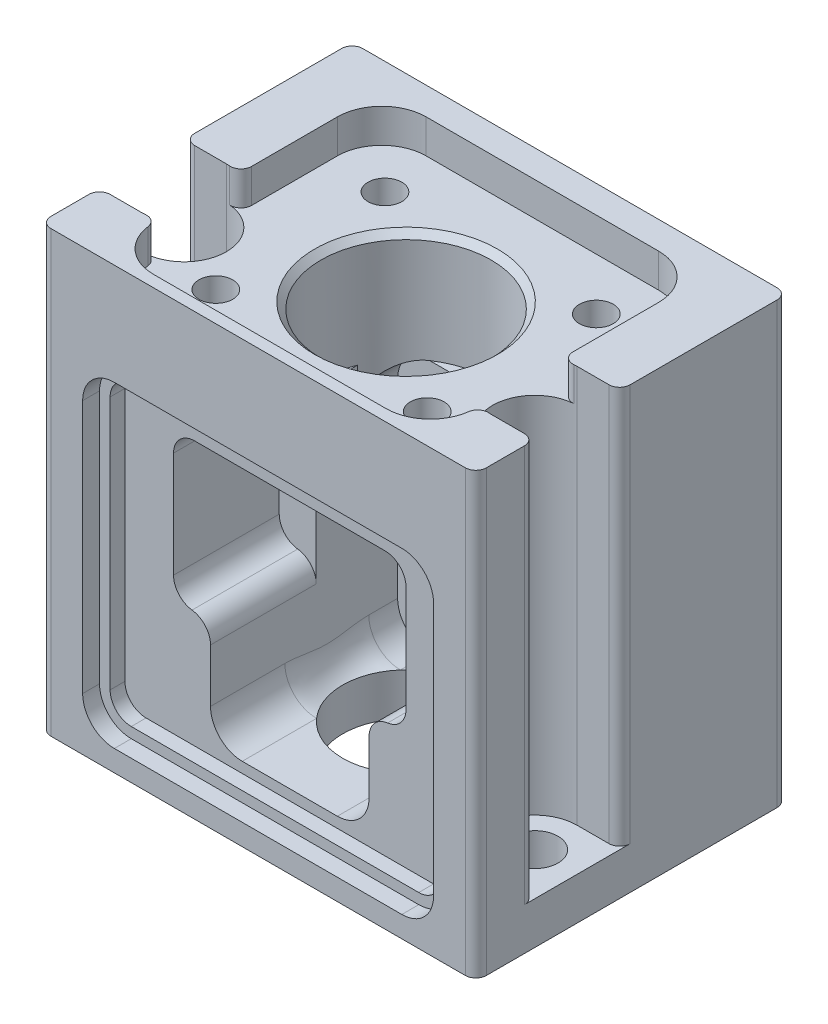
SolidWorks part; units mm, degrees
ref_plane "前视基准面" through (0, 0, 0) normal (0, 0, 1) x (1, 0, 0)
ref_plane "上视基准面" through (0, 0, 0) normal (0, 1, 0) x (1, 0, 0)
ref_plane "右视基准面" through (0, 0, 0) normal (1, 0, 0) x (0, 0, -1)
sketch "草图1" plane through (0, 0, 0) normal (0, 1, 0) x (1, 0, 0)
  line L1 (-10.3, 6.875) -> (10.3, 6.875)
  line L2 (-10.3, 6.875) -> (-10.3, -6.875)
  line L3 (-10.3, -6.875) -> (10.3, -6.875)
  line L4 (10.3, 6.875) -> (10.3, -6.875)
  line L5 (-10.3, 6.875) -> (10.3, -6.875) construction
  line L6 (-10.3, -6.875) -> (10.3, 6.875) construction
  point P0 (0, 0)
  dimension "D1" = 20.6
  dimension "D2" = 13.75
extrude "凸台-拉伸1" add sketch "草图1" along normal blind 22
sketch "草图3" plane through (0, 0, 0) normal (0, -1, 0) x (1, 0, 0)
  line L0 (10.3, -6.875) -> (-10.3, -6.875) construction
  line L1 (-10.3, -6.875) -> (-10.3, 6.875) construction
  circle A0 centre (-6, -0.625) radius 0.975
  circle A1 centre (7, -0.625) radius 0.975
  dimension "D1" = 6.25
  dimension "D2" = 6.25
  dimension "D3" = 4.3
  dimension "D4" = 13
  dimension "D5" = 1.95
extrude "切除-拉伸1" cut sketch "草图3" against normal blind 4
sketch "草图4" plane through (0, 0, 0) normal (0, -1, 0) x (1, 0, 0)
  circle A0 centre (-6, -0.625) radius 1.025
  circle A1 centre (7, -0.625) radius 1.025
  dimension "D1" = 2.05
extrude "切除-拉伸2" cut sketch "草图4" against normal blind 2
sketch "草图5" plane through (0, 0, 6.875) normal (0, 0, 1) x (1, 0, 0)
  line L4 (-10.3, 0) -> (10.3, 0)
  line L5 (10.3, 0) -> (10.3, 22)
  line L6 (10.3, 22) -> (-10.3, 22)
  line L7 (-10.3, 22) -> (-10.3, 0)
  line L8 (-10.3, 0) -> (10.3, 0)
  line L9 (10.3, 0) -> (10.3, 22)
  line L10 (10.3, 22) -> (-10.3, 22)
  line L11 (-10.3, 22) -> (-10.3, 0)
  dimension "D1" = 0
extrude "凸台-拉伸2" [suppressed] add sketch "草图5" along normal blind 1.75
sketch "草图6" plane through (0, 22, 0) normal (0, 1, 0) x (1, 0, 0)
  circle A0 centre (-5.8, 3.925) radius 2
  circle A1 centre (5.8, 3.925) radius 2
  circle A2 centre (5.8, -3.075) radius 2
  circle A3 centre (-5.8, -3.075) radius 2
  dimension "D1" = 4
extrude "切除-拉伸3" [suppressed] cut sketch "草图6" against normal blind 18
sketch "草图7" [suppressed] plane through (0, 2, 0) normal (0, 1, 0) x (1, 0, 0)
  circle A0 centre (5.8, 3.925) radius 1.1
  circle A1 centre (5.8, -3.075) radius 1.1
  circle A2 centre (-5.8, -3.075) radius 1.1
  circle A3 centre (-5.8, 3.925) radius 1.1
  dimension "D1" = 2.2
extrude "切除-拉伸4" [suppressed] cut sketch "草图7" against normal through all
sketch "草图8" plane through (0, 22, 0) normal (0, 1, 0) x (1, 0, 0)
  line L0 (10.3, -6.875) -> (10.3, 6.875) construction
  line L1 (8.2882, -1.075) -> (10.3, -1.075)
  line L3 (8.2882, -5.075) -> (10.3, -5.075)
  line L4 (10.3, -1.075) -> (10.3, -5.075)
  line L5 (-10.3, 6.875) -> (-10.3, -6.875) construction
  line L6 (-8.3, -5.075) -> (-10.3, -5.075)
  line L8 (-8.3, -1.075) -> (-10.3, -1.075)
  line L9 (-10.3, -5.075) -> (-10.3, -1.075)
  arc A0 (8.2882, -1.075) -> (8.2882, -5.075) centre (8.2882, -3.075) ccw
  arc A1 (-8.3, -5.075) -> (-8.3, -1.075) centre (-8.3, -3.075) ccw
  dimension "D1" = 4
  dimension "D2" = 4
extrude "切除-拉伸7" cut sketch "草图8" against normal blind 20
sketch "草图9" plane through (0, 2, 0) normal (0, 1, 0) x (1, 0, 0)
  circle A0 centre (8.2882, -3.075) radius 1.1
  circle A1 centre (-8.3, -3.075) radius 1.1
  dimension "D1" = 2.2
extrude "切除-拉伸8" cut sketch "草图9" against normal blind 18
sketch "草图10" plane through (0, 0, 6.875) normal (0, 0, 1) x (1, 0, 0)
  line L4 (-10.3, 0) -> (10.3, 0)
  line L5 (10.3, 0) -> (10.3, 22)
  line L6 (10.3, 22) -> (-10.3, 22)
  line L7 (-10.3, 22) -> (-10.3, 0)
  line L8 (-10.3, 0) -> (10.3, 0)
  line L9 (10.3, 0) -> (10.3, 22)
  line L10 (10.3, 22) -> (-10.3, 22)
  line L11 (-10.3, 22) -> (-10.3, 0)
  dimension "D1" = 0
extrude "凸台-拉伸3" add sketch "草图10" along normal blind 1
sketch "草图11" plane through (0, 0, 7.875) normal (0, 0, 1) x (1, 0, 0)
  line L0 (0, 0) -> (0, 39.1012) construction
  line L1 (-10.3, 0) -> (10.3, 0) construction
  line L2 (3.75, 2) -> (-3.75, 2)
  line L3 (3.75, 2) -> (3.75, 14)
  line L4 (3.75, 14) -> (-3.75, 14)
  line L5 (-3.75, 2) -> (-3.75, 14)
  dimension "D1" = 2
  dimension "D2" = 3.75
  dimension "D3" = 3.75
  dimension "D4" = 12
extrude "切除-拉伸9" cut sketch "草图11" against normal blind 10.35
sketch "草图12" plane through (0, 22, 0) normal (0, 1, 0) x (1, 0, 0)
  circle A0 centre (0, -0.875) radius 4.025
  dimension "D1" = 8.05
extrude "切除-拉伸10" cut sketch "草图12" against normal up to surface (8 mm away)
sketch "草图17" plane through (0, 0, 7.875) normal (0, 0, 1) x (1, 0, 0)
  line L0 (-10.3, 0) -> (10.3, 0) construction
  line L1 (8.3, 1) -> (-8.3, 1)
  line L2 (8.3, 1) -> (8.3, 16)
  line L3 (8.3, 16) -> (-8.3, 16)
  line L4 (-8.3, 1) -> (-8.3, 16)
  line L5 (10.3, 0) -> (10.3, 22) construction
  line L6 (-10.3, 22) -> (-10.3, 0) construction
  dimension "D1" = 1
  dimension "D2" = 2
  dimension "D3" = 2
  dimension "D4" = 15
extrude "切除-拉伸13" cut sketch "草图17" against normal blind 0.8
fillet "圆角1" radius 1.5 4 edges at (-8.3, 1, 7.475) (-8.3, 16, 7.475) (8.3, 16, 7.475) (8.3, 1, 7.475)
sketch "草图19" plane through (0, 0, 7.075) normal (0, 0, 1) x (1, 0, 0)
  line L0 (-7.8, 14.5) -> (-7.8, 2.5)
  line L1 (-6.8, 1.5) -> (6.8, 1.5)
  line L2 (7.8, 2.5) -> (7.8, 14.5)
  line L3 (6.8, 15.5) -> (-6.8, 15.5)
  line L4 (-8.3, 14.5) -> (-8.3, 2.5)
  line L5 (-6.8, 1) -> (6.8, 1)
  line L6 (8.3, 2.5) -> (8.3, 14.5)
  line L7 (6.8, 16) -> (-6.8, 16)
  line L8 (-8.3, 14.5) -> (-8.3, 2.5) construction
  line L9 (-6.8, 1) -> (6.8, 1) construction
  line L10 (8.3, 2.5) -> (8.3, 14.5) construction
  line L11 (6.8, 16) -> (-6.8, 16) construction
  arc A0 (-7.8, 2.5) -> (-6.8, 1.5) centre (-6.8, 2.5) ccw
  arc A1 (6.8, 1.5) -> (7.8, 2.5) centre (6.8, 2.5) ccw
  arc A2 (7.8, 14.5) -> (6.8, 15.5) centre (6.8, 14.5) ccw
  arc A3 (-6.8, 15.5) -> (-7.8, 14.5) centre (-6.8, 14.5) ccw
  arc A4 (-8.3, 2.5) -> (-6.8, 1) centre (-6.8, 2.5) ccw
  arc A5 (6.8, 1) -> (8.3, 2.5) centre (6.8, 2.5) ccw
  arc A6 (8.3, 14.5) -> (6.8, 16) centre (6.8, 14.5) ccw
  arc A7 (-6.8, 16) -> (-8.3, 14.5) centre (-6.8, 14.5) ccw
  arc A8 (-8.3, 2.5) -> (-6.8, 1) centre (-6.8, 2.5) ccw construction
  arc A9 (6.8, 1) -> (8.3, 2.5) centre (6.8, 2.5) ccw construction
  arc A10 (8.3, 14.5) -> (6.8, 16) centre (6.8, 14.5) ccw construction
  arc A11 (-6.8, 16) -> (-8.3, 14.5) centre (-6.8, 14.5) ccw construction
  dimension "D1" = 0
  dimension "D2" = 0.5
extrude "切除-拉伸14" cut sketch "草图19" against normal blind 0.7
sketch "草图21" plane through (0, 22, 0) normal (0, 1, 0) x (1, 0, 0)
  line L10 (-8.3, -5.075) -> (-10.3, -5.075)
  line L11 (-10.3, -5.075) -> (-10.3, -7.875)
  line L12 (-10.3, -7.875) -> (10.3, -7.875)
  line L13 (10.3, -7.875) -> (10.3, -5.075)
  line L14 (10.3, -5.075) -> (8.2882, -5.075)
  line L15 (8.2882, -1.075) -> (10.3, -1.075)
  line L16 (10.3, -1.075) -> (10.3, 6.875)
  line L17 (10.3, 6.875) -> (-10.3, 6.875)
  line L18 (-10.3, 6.875) -> (-10.3, -1.075)
  line L19 (-10.3, -1.075) -> (-8.3, -1.075)
  line L20 (-8.3, -5.075) -> (-10.3, -5.075)
  line L21 (-10.3, -5.075) -> (-10.3, -7.875)
  line L22 (-10.3, -7.875) -> (10.3, -7.875)
  line L23 (10.3, -7.875) -> (10.3, -5.075)
  line L24 (10.3, -5.075) -> (8.2882, -5.075)
  line L25 (8.2882, -1.075) -> (10.3, -1.075)
  line L26 (10.3, -1.075) -> (10.3, 6.875)
  line L27 (10.3, 6.875) -> (-10.3, 6.875)
  line L28 (-10.3, 6.875) -> (-10.3, -1.075)
  line L29 (-10.3, -1.075) -> (-8.3, -1.075)
  arc A2 (8.2882, -1.075) -> (8.2882, -5.075) centre (8.2882, -3.075) ccw
  arc A3 (-8.3, -5.075) -> (-8.3, -1.075) centre (-8.3, -3.075) ccw
  arc A4 (8.2882, -1.075) -> (8.2882, -5.075) centre (8.2882, -3.075) ccw
  arc A5 (-8.3, -5.075) -> (-8.3, -1.075) centre (-8.3, -3.075) ccw
  dimension "D1" = 0
extrude "切除-拉伸16" cut sketch "草图21" against normal blind 1.2
sketch "草图22" plane through (0, 20.8, 0) normal (0, 1, 0) x (1, 0, 0)
  line L8 (-5.5, 5.575) -> (5.5, 5.575)
  line L9 (7.6, 3.475) -> (7.6, -5.225)
  line L10 (5.5, -7.325) -> (-5.5, -7.325)
  line L11 (-7.6, -5.225) -> (-7.6, 3.475)
  arc A8 (7.6, 3.475) -> (5.5, 5.575) centre (5.5, 3.475) ccw
  arc A9 (5.5, -7.325) -> (7.6, -5.225) centre (5.5, -5.225) ccw
  arc A10 (-7.6, -5.225) -> (-5.5, -7.325) centre (-5.5, -5.225) ccw
  arc A11 (-5.5, 5.575) -> (-7.6, 3.475) centre (-5.5, 3.475) ccw
extrude "切除-拉伸17" cut sketch "草图22" against normal blind 1.6
sketch "草图23" plane through (0, 0, 0) normal (0, -1, 0) x (1, 0, 0)
  circle A0 centre (0, 0.875) radius 3
  dimension "D1" = 6
extrude "切除-拉伸18" cut sketch "草图23" against normal blind 5
fillet "圆角2" radius 1.5 6 edges at (-3.75, 14, -1.5311) (-3.75, 14, 4.3561) (3.75, 14, 4.3561) (3.75, 14, -1.5311) (3.75, 2, 1.95) (-3.75, 2, 1.95)
hole_wizard "M2 螺纹孔2" positions "草图24" profile "草图25" tap size "M2" standard "GB"
sketch "草图24" plane through (0, 19.2, 0) normal (0, 1, 0) x (1, 0, 0)
  point P0 (5, -4.875)
  point P3 (5, 3.125)
  point P6 (-5, 3.125)
  point P9 (-5, -4.875)
sketch "草图25" plane through (5, 19.2, 4.875) normal (1, 0, 0) x (0, 0, 1)
  line L0 (0, 0) -> (0, 4.9807)
  line L1 (0, 4.9807) -> (0.8, 4.5)
  line L2 (0.8, 4.5) -> (0.8, 0)
  line L5 (0.8, 0) -> (0, 0)
  line L10 (0, 4.9807) -> (-0.8, 4.5) construction
  line L11 (0, -6.35) -> (0, 107.95) construction
  dimension "螺纹孔钻头直径" = 1.6
  dimension "螺纹孔钻头深度" = 4.5
  dimension "导头角度" = 118
fillet "圆角5" radius 0.5 12 edges at (-7.6, 20, 4.9485) (-7.6, 20, 1.2015) (7.6, 20, 1.1971) (7.6, 20, 4.9529) (10.3, 11.4, 5.075) (10.3, 11.4, 1.075) (-10.3, 11.4, 1.075) (-10.3, 11.4, 5.075) (-10.3, 10.4, 7.875) (-10.3, 10.4, -6.875) (10.3, 10.4, -6.875) (10.3, 10.4, 7.875)
chamfer "倒角2" distance 0.3 angle 45 1 edges at (0, 19.2, 4.9)
sketch "草图26" plane through (0, 0, 6.375) normal (0, 0, 1) x (1, 0, 0)
  line L0 (2.2312, 14) -> (-2.2312, 14) construction
  line L1 (-5.5, 7) -> (5.5, 7)
  line L2 (-5.5, 7) -> (-5.5, 14)
  line L3 (-5.5, 14) -> (5.5, 14)
  line L4 (5.5, 7) -> (5.5, 14)
  line L5 (-3.75, 12.5) -> (-3.75, 3.5) construction
  line L6 (3.75, 12.5) -> (3.75, 3.5) construction
  dimension "D1" = 1.75
  dimension "D2" = 1.75
  dimension "D3" = 7
extrude "切除-拉伸19" cut sketch "草图26" against normal blind 5
fillet "圆角6" radius 1 4 edges at (5.5, 14, 3.875) (5.5, 7, 3.875) (-5.5, 7, 3.875) (-5.5, 14, 3.875)
fillet "圆角7" radius 1 2 edges at (3.75, 7, 3.875) (-3.75, 7, 3.875)
sketch "草图27" plane through (0, 0, 0) normal (0, -1, 0) x (1, 0, 0)
  circle A0 centre (0, 0.875) radius 4.25 construction
  circle A1 centre (0, 0.875) radius 4.9
  circle A2 centre (0, 0.875) radius 3.6
  dimension "D1" = 8.5
  dimension "D2" = 0.65
  dimension "D3" = 0.65
extrude "切除-拉伸20" cut sketch "草图27" against normal blind 0.8
